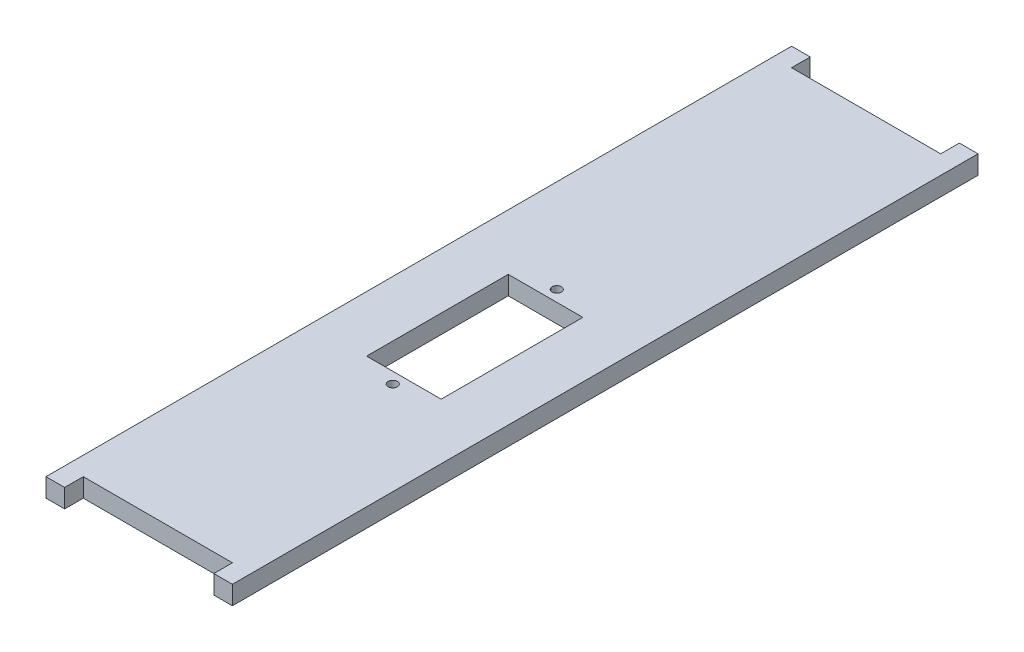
SolidWorks part; units mm, degrees
ref_plane "Front Plane" through (0, 0, 0) normal (0, 0, 1) x (1, 0, 0)
ref_plane "Top Plane" through (0, 0, 0) normal (0, 1, 0) x (1, 0, 0)
ref_plane "Right Plane" through (0, 0, 0) normal (1, 0, 0) x (0, 0, -1)
sketch "Sketch1" plane through (0, 0, 0) normal (0, 1, 0) x (1, 0, 0)
  line L1 (-15.875, 63.5) -> (15.875, 63.5)
  line L2 (-15.875, 63.5) -> (-15.875, -63.5)
  line L3 (-15.875, -63.5) -> (15.875, -63.5)
  line L4 (15.875, 63.5) -> (15.875, -63.5)
  line L5 (-15.875, 63.5) -> (15.875, -63.5) construction
  line L6 (-15.875, -63.5) -> (15.875, 63.5) construction
  point P0 (0, 0)
  dimension "D1" = 127
  dimension "D2" = 31.75
extrude "Boss-Extrude1" add sketch "Sketch1" along normal mid plane 3.175
sketch "Sketch2" plane through (0, 1.5875, 0) normal (0, 1, 0) x (1, 0, 0)
  line L0 (-15.875, -63.5) -> (15.875, -63.5) construction
  line L1 (-12.7, -60.325) -> (12.7, -60.325)
  line L2 (-12.7, -60.325) -> (-12.7, -63.5)
  line L3 (-12.7, -63.5) -> (12.7, -63.5)
  line L4 (12.7, -60.325) -> (12.7, -63.5)
  line L5 (-12.7, -60.325) -> (12.7, -63.5) construction
  line L6 (-12.7, -63.5) -> (12.7, -60.325) construction
  line L7 (-23.0958, 0) -> (24.0208, 0) construction
  line L8 (-12.7, 63.5) -> (12.7, 60.325) construction
  line L9 (-12.7, 60.325) -> (12.7, 63.5) construction
  line L10 (12.7, 60.325) -> (12.7, 63.5)
  line L11 (-12.7, 63.5) -> (12.7, 63.5)
  line L12 (-12.7, 60.325) -> (-12.7, 63.5)
  line L13 (-12.7, 60.325) -> (12.7, 60.325)
  point P0 (0, -61.9125)
  point P14 (0, 61.9125)
  dimension "D1" = 3.175
  dimension "D2" = 25.4
extrude "Cut-Extrude1" cut sketch "Sketch2" against normal through all
sketch "Sketch3" plane through (0, 1.5875, 0) normal (0, 1, 0) x (1, 0, 0)
  line L1 (-6.35, 5.715) -> (6.35, 5.715)
  line L2 (-6.35, 5.715) -> (-6.35, -18.415)
  line L3 (-6.35, -18.415) -> (6.35, -18.415)
  line L4 (6.35, 5.715) -> (6.35, -18.415)
  line L5 (-6.35, 5.715) -> (6.35, -18.415) construction
  line L6 (-6.35, -18.415) -> (6.35, 5.715) construction
  point P0 (0, -6.35)
  dimension "D1" = 24.13
  dimension "D2" = 12.7
  dimension "D3" = 6.35
extrude "Cut-Extrude2" cut sketch "Sketch3" against normal through all
hole_wizard "1/16 (0.0625) Diameter Hole1" positions "Sketch5" profile "Sketch4" hole size "1/16" standard "Ansi Inch"
sketch "Sketch5" plane through (0, 1.5875, 0) normal (0, 1, 0) x (-1, 0, 0)
  line L0 (-6.35, -5.715) -> (6.35, -5.715) construction
  line L1 (6.35, 18.415) -> (-6.35, 18.415) construction
  point P0 (0, 20.32)
  point P1 (0, -7.62)
  dimension "D1" = 1.905
  dimension "D2" = 1.905
sketch "Sketch4" plane through (0, 1.5875, 20.32) normal (1, 0, 0) x (0, 0, 1)
  line L0 (0, 0) -> (0, 3.7789)
  line L1 (0, 3.7789) -> (0.7937, 3.302)
  line L2 (0.7937, 3.302) -> (0.7937, 0)
  line L5 (0.7937, 0) -> (0, 0)
  line L10 (0, 3.7789) -> (-0.7937, 3.302) construction
  line L11 (0, -6.35) -> (0, 107.95) construction
  dimension "Hole Dia." = 1.5875
  dimension "Hole Depth" = 3.302
  dimension "Drill Angle" = 118
